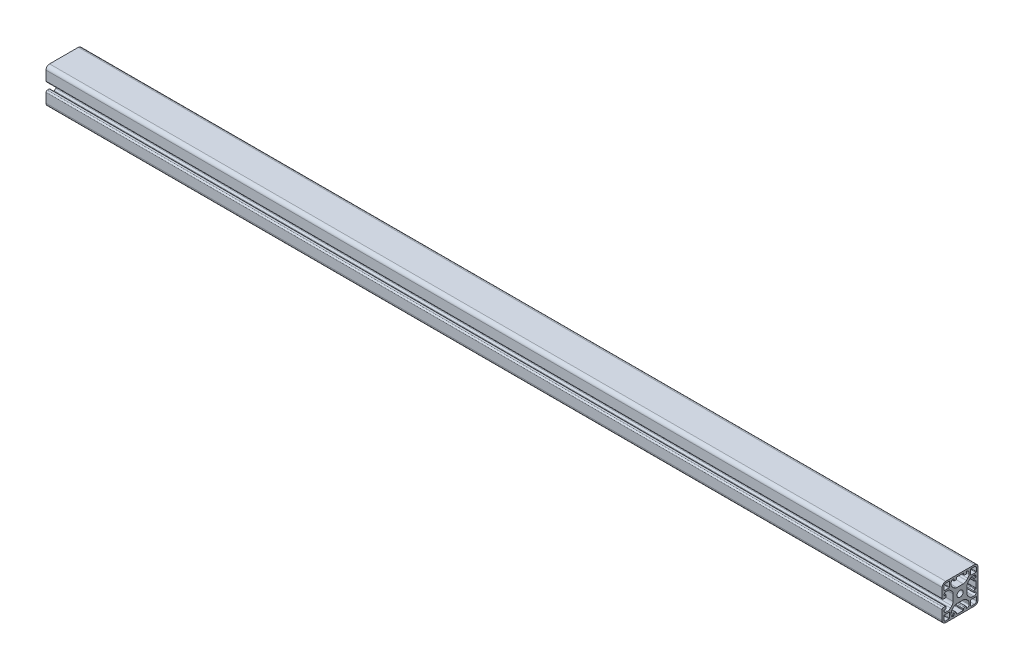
SolidWorks part; units mm, degrees
ref_plane "Ebene vorne" through (0, 0, 0) normal (0, 0, 1) x (1, 0, 0)
ref_plane "Ebene oben" through (0, 0, 0) normal (0, 1, 0) x (1, 0, 0)
ref_plane "Ebene rechts" through (0, 0, 0) normal (1, 0, 0) x (0, 0, -1)
sketch "Skizze1" plane through (0, 0, 0) normal (0, 1, 0) x (1, 0, 0)
  line L0 (0, 0) -> (1000, 0)
  dimension "D1" = 1000
other "Strukturbauteil1"
ref_plane "Ebene1" through (0, 0, 0) normal (1, 0, 0) x (0, 1, 0)
sketch "Model1" plane through (0, 0, 0) normal (1, 0, 0) x (0, 1, 0)
  line L0 (-20, 16) -> (-20, -16)
  line L1 (-16, -20) -> (16, -20)
  line L2 (-18.2, 16) -> (-18.2, 12.3)
  line L3 (-18.2, -12.3) -> (-18.2, -16)
  line L4 (-17.9999, 3.4999) -> (-17.9999, -3.4999)
  line L5 (-16, -18.2) -> (-12.3, -18.2)
  line L6 (12.3, -18.2) -> (16, -18.2)
  line L7 (-3.5, -18) -> (3.5, -18)
  line L8 (-15.4999, 6.4999) -> (-15.4999, 4.9999)
  line L9 (-15.4999, -4.9999) -> (-15.4999, -6.4999)
  line L10 (-6.5, -15.5) -> (-5, -15.5)
  line L11 (5, -15.5) -> (6.5, -15.5)
  line L12 (-11.8, -17.7) -> (-11.8, -12.3)
  line L13 (-11.8, 12.3) -> (-11.8, 17.7)
  line L14 (17.7, -11.8) -> (12.3, -11.8)
  line L15 (-12.3, -11.8) -> (-17.7, -11.8)
  line L16 (-10, 15.5) -> (-10, 14.1912)
  line L17 (-10, -14.1912) -> (-10, -15.5)
  line L18 (-15.4999, -9.9999) -> (-14.1909, -9.9999)
  line L19 (14.1909, -9.9999) -> (15.4999, -9.9999)
  line L20 (-7.75, -3.5589) -> (-7.75, 3.559)
  line L21 (3.559, -7.75) -> (-3.5588, -7.75)
  line L22 (-7, -17.5) -> (-7, -16)
  line L23 (-7, 16) -> (-7, 17.5)
  line L24 (17.4999, -6.9999) -> (15.9999, -6.9999)
  line L25 (-15.9999, -6.9999) -> (-17.4999, -6.9999)
  line L26 (-4, 18.5) -> (-4, 16.5)
  line L27 (-4, -17.5) -> (-4, -16.5)
  line L28 (-17.4999, -3.9999) -> (-16.4999, -3.9999)
  line L29 (17.4999, -3.9999) -> (16.4999, -3.9999)
  line L30 (-10.6554, -8.5355) -> (-9.2144, -7.0945)
  line L31 (7.0945, 9.2145) -> (8.5355, 10.6555)
  line L32 (8.5355, -10.6555) -> (7.0945, -9.2145)
  line L33 (-9.2144, 7.0945) -> (-10.6554, 8.5355)
  line L34 (10.6554, 8.5355) -> (9.2144, 7.0945)
  line L35 (-7.0944, -9.2145) -> (-8.5355, -10.6557)
  line L36 (-8.5355, 10.6557) -> (-7.0944, 9.2145)
  line L37 (9.2144, -7.0945) -> (10.6554, -8.5355)
  line L38 (4, 18.5) -> (4, 16.5)
  line L39 (4, -17.5) -> (4, -16.5)
  line L40 (-17.4999, 3.9999) -> (-16.4999, 3.9999)
  line L41 (17.4999, 3.9999) -> (16.4999, 3.9999)
  line L42 (7, 17.5) -> (7, 16)
  line L43 (7, -16) -> (7, -17.5)
  line L44 (7.75, 3.5589) -> (7.75, -3.5589)
  line L45 (-17.4999, 6.9999) -> (-15.9999, 6.9999)
  line L46 (15.9999, 6.9999) -> (17.4999, 6.9999)
  line L47 (-3.5588, 7.75) -> (3.559, 7.75)
  line L48 (10, -15.5) -> (10, -14.191)
  line L49 (10, 14.191) -> (10, 15.5)
  line L50 (15.4999, 9.9999) -> (14.1909, 9.9999)
  line L51 (-14.1909, 9.9999) -> (-15.4999, 9.9999)
  line L52 (11.8, 17.7) -> (11.8, 12.3)
  line L53 (11.8, -12.3) -> (11.8, -17.7)
  line L54 (-17.7, 11.8) -> (-12.3, 11.8)
  line L55 (12.3, 11.8) -> (17.7, 11.8)
  line L56 (15.4999, -6.4999) -> (15.4999, -4.9999)
  line L57 (15.4999, 4.9999) -> (15.4999, 6.4999)
  line L58 (6.5, 15.5) -> (5, 15.5)
  line L59 (-5, 15.5) -> (-6.5, 15.5)
  line L60 (17.9999, -3.4999) -> (17.9999, 3.4999)
  line L61 (18.2, -16) -> (18.2, -12.3)
  line L62 (18.2, 12.3) -> (18.2, 16)
  line L63 (16, 18.2) -> (12.3, 18.2)
  line L64 (-12.3, 18.2) -> (-16, 18.2)
  line L65 (20, -16) -> (20, 16)
  line L66 (16, 20) -> (5.5, 20)
  line L67 (-5.5, 20) -> (-16, 20)
  line L69 (-20, -20) -> (20, -20) construction
  line L70 (-20, -20) -> (-20, 20) construction
  line L71 (-20, 20) -> (20, 20) construction
  line L72 (20, -20) -> (20, 20) construction
  line L73 (0, 20) -> (0, -20) construction
  line L74 (-20, 0) -> (20, 0) construction
  arc A0 (-14.1909, -9.9999) -> (-10.6554, -8.5355) centre (-14.1909, -4.9999) ccw
  arc A1 (-8.5355, -10.6557) -> (-10, -14.1912) centre (-5, -14.1912) ccw
  arc A2 (-3.5588, -7.75) -> (-7.0944, -9.2145) centre (-3.5588, -12.75) ccw
  arc A3 (-9.2144, -7.0945) -> (-7.75, -3.5589) centre (-12.75, -3.5589) ccw
  arc A4 (-20, -16) -> (-16, -20) centre (-16, -16) ccw
  arc A5 (-10, -15.5) -> (-7.5, -18) centre (-7.5, -15.5) ccw
  arc A6 (-17.9999, -7.4999) -> (-15.4999, -9.9999) centre (-15.4999, -7.4999) ccw
  arc A7 (-18.2, -16) -> (-16, -18.2) centre (-16, -16) ccw
  arc A8 (-15.4999, -4.9999) -> (-16.4999, -3.9999) centre (-16.4999, -4.9999) ccw
  arc A9 (-4, -16.5) -> (-5, -15.5) centre (-5, -16.5) ccw
  arc A10 (-15.9999, -6.9999) -> (-15.4999, -6.4999) centre (-15.9999, -6.4999) ccw
  arc A11 (-6.5, -15.5) -> (-7, -16) centre (-6.5, -16) ccw
  arc A12 (-17.9999, -3.4999) -> (-17.4999, -3.9999) centre (-17.4999, -3.4999) ccw
  arc A13 (-4, -17.5) -> (-3.5, -18) centre (-3.5, -17.5) ccw
  arc A14 (-17.4999, -6.9999) -> (-17.9999, -7.4999) centre (-17.4999, -7.4999) ccw
  arc A15 (-7.5, -18) -> (-7, -17.5) centre (-7.5, -17.5) ccw
  arc A16 (-17.7, -11.8) -> (-18.2, -12.3) centre (-17.7, -12.3) ccw
  arc A17 (-12.3, -18.2) -> (-11.8, -17.7) centre (-12.3, -17.7) ccw
  arc A18 (-11.8, -12.3) -> (-12.3, -11.8) centre (-12.3, -12.3) ccw
  arc A19 (-10, 14.1912) -> (-8.5355, 10.6557) centre (-5, 14.1912) ccw
  arc A20 (-10.6554, 8.5355) -> (-14.1909, 9.9999) centre (-14.1909, 4.9999) ccw
  arc A21 (-7.75, 3.559) -> (-9.2144, 7.0945) centre (-12.75, 3.559) ccw
  arc A22 (-7.0944, 9.2145) -> (-3.5588, 7.75) centre (-3.5588, 12.75) ccw
  arc A23 (-16, 20) -> (-20, 16) centre (-16, 16) ccw
  arc A24 (-15.4999, 9.9999) -> (-17.9999, 7.4999) centre (-15.4999, 7.4999) ccw
  arc A25 (-7.5, 18) -> (-10, 15.5) centre (-7.5, 15.5) ccw
  arc A26 (-16, 18.2) -> (-18.2, 16) centre (-16, 16) ccw
  arc A27 (-4, 18.5) -> (-5.5, 20) centre (-5.5, 18.5) ccw
  arc A28 (-16.4999, 3.9999) -> (-15.4999, 4.9999) centre (-16.4999, 4.9999) ccw
  arc A29 (-5, 15.5) -> (-4, 16.5) centre (-5, 16.5) ccw
  arc A30 (-7, 16) -> (-6.5, 15.5) centre (-6.5, 16) ccw
  arc A31 (-15.4999, 6.4999) -> (-15.9999, 6.9999) centre (-15.9999, 6.4999) ccw
  arc A32 (-17.4999, 3.9999) -> (-17.9999, 3.4999) centre (-17.4999, 3.4999) ccw
  arc A33 (-7, 17.5) -> (-7.5, 18) centre (-7.5, 17.5) ccw
  arc A34 (-17.9999, 7.4999) -> (-17.4999, 6.9999) centre (-17.4999, 7.4999) ccw
  arc A35 (-11.8, 17.7) -> (-12.3, 18.2) centre (-12.3, 17.7) ccw
  arc A36 (-18.2, 12.3) -> (-17.7, 11.8) centre (-17.7, 12.3) ccw
  arc A37 (-12.3, 11.8) -> (-11.8, 12.3) centre (-12.3, 12.3) ccw
  arc A38 (10, -14.191) -> (8.5355, -10.6555) centre (5, -14.191) ccw
  arc A39 (10.6554, -8.5355) -> (14.1909, -9.9999) centre (14.1909, -4.9999) ccw
  arc A40 (7.75, -3.5589) -> (9.2144, -7.0945) centre (12.75, -3.5589) ccw
  arc A41 (7.0945, -9.2145) -> (3.559, -7.75) centre (3.559, -12.75) ccw
  arc A42 (16, -20) -> (20, -16) centre (16, -16) ccw
  circle A43 centre (0, 0) radius 3.4
  arc A44 (15.4999, -9.9999) -> (17.9999, -7.4999) centre (15.4999, -7.4999) ccw
  arc A45 (7.5, -18) -> (10, -15.5) centre (7.5, -15.5) ccw
  arc A46 (16, -18.2) -> (18.2, -16) centre (16, -16) ccw
  arc A47 (16.4999, -3.9999) -> (15.4999, -4.9999) centre (16.4999, -4.9999) ccw
  arc A48 (5, -15.5) -> (4, -16.5) centre (5, -16.5) ccw
  arc A49 (15.4999, -6.4999) -> (15.9999, -6.9999) centre (15.9999, -6.4999) ccw
  arc A50 (7, -16) -> (6.5, -15.5) centre (6.5, -16) ccw
  arc A51 (17.4999, -3.9999) -> (17.9999, -3.4999) centre (17.4999, -3.4999) ccw
  arc A52 (3.5, -18) -> (4, -17.5) centre (3.5, -17.5) ccw
  arc A53 (17.9999, -7.4999) -> (17.4999, -6.9999) centre (17.4999, -7.4999) ccw
  arc A54 (7, -17.5) -> (7.5, -18) centre (7.5, -17.5) ccw
  arc A55 (18.2, -12.3) -> (17.7, -11.8) centre (17.7, -12.3) ccw
  arc A56 (12.3, -11.8) -> (11.8, -12.3) centre (12.3, -12.3) ccw
  arc A57 (11.8, -17.7) -> (12.3, -18.2) centre (12.3, -17.7) ccw
  arc A58 (8.5355, 10.6555) -> (10, 14.191) centre (5, 14.191) ccw
  arc A59 (14.1909, 9.9999) -> (10.6554, 8.5355) centre (14.1909, 4.9999) ccw
  arc A60 (9.2144, 7.0945) -> (7.75, 3.5589) centre (12.75, 3.5589) ccw
  arc A61 (3.559, 7.75) -> (7.0945, 9.2145) centre (3.559, 12.75) ccw
  arc A62 (20, 16) -> (16, 20) centre (16, 16) ccw
  arc A63 (17.9999, 7.4999) -> (15.4999, 9.9999) centre (15.4999, 7.4999) ccw
  arc A64 (10, 15.5) -> (7.5, 18) centre (7.5, 15.5) ccw
  arc A65 (18.2, 16) -> (16, 18.2) centre (16, 16) ccw
  arc A66 (5.5, 20) -> (4, 18.5) centre (5.5, 18.5) ccw
  arc A67 (15.4999, 4.9999) -> (16.4999, 3.9999) centre (16.4999, 4.9999) ccw
  arc A68 (4, 16.5) -> (5, 15.5) centre (5, 16.5) ccw
  arc A69 (15.9999, 6.9999) -> (15.4999, 6.4999) centre (15.9999, 6.4999) ccw
  arc A70 (6.5, 15.5) -> (7, 16) centre (6.5, 16) ccw
  arc A71 (17.9999, 3.4999) -> (17.4999, 3.9999) centre (17.4999, 3.4999) ccw
  arc A72 (17.4999, 6.9999) -> (17.9999, 7.4999) centre (17.4999, 7.4999) ccw
  arc A73 (7.5, 18) -> (7, 17.5) centre (7.5, 17.5) ccw
  arc A74 (12.3, 18.2) -> (11.8, 17.7) centre (12.3, 17.7) ccw
  arc A75 (11.8, 12.3) -> (12.3, 11.8) centre (12.3, 12.3) ccw
  arc A76 (17.7, 11.8) -> (18.2, 12.3) centre (17.7, 12.3) ccw
  point P221 (0, 0)
  point P222 (-20, 20)
  point P223 (0, 20)
  point P224 (20, 20)
  point P228 (20, -20)
  point P229 (20, 0)
  point P230 (0, -20)
  point P231 (-20, -20)
  point P232 (-20, 0)
  point P233 (0, 0)
